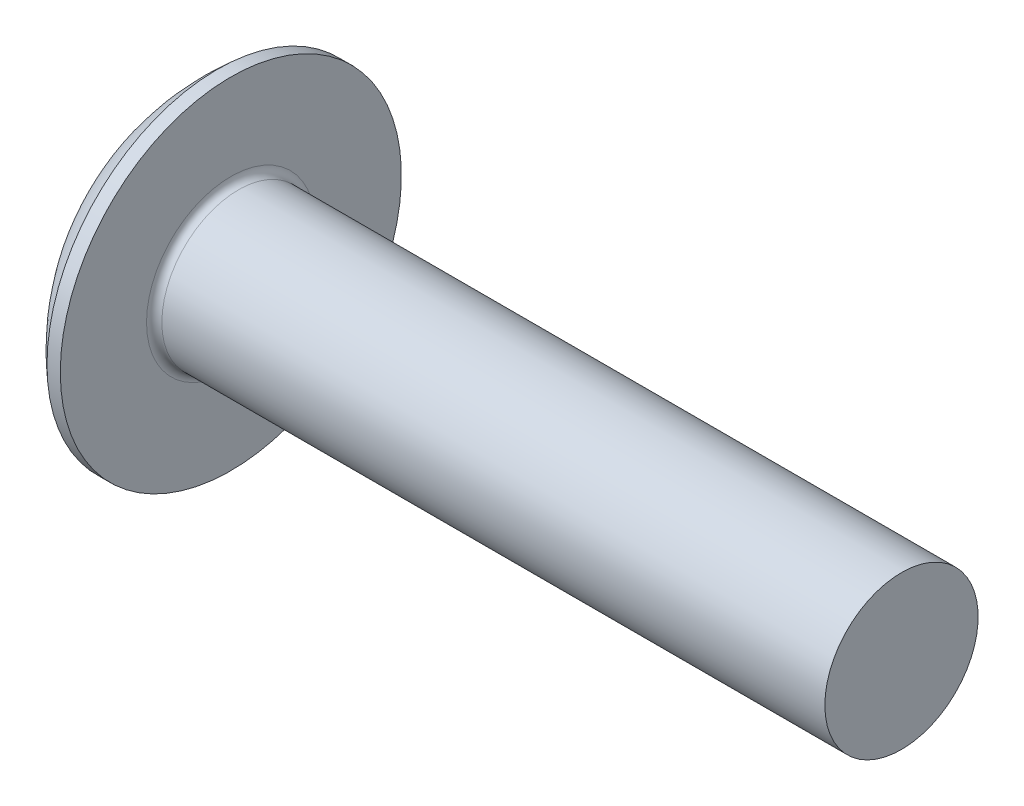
SolidWorks part; units mm, degrees
ref_plane "Plane1" through (0, 0, 0) normal (0, 0, 1) x (1, 0, 0)
ref_plane "Plane2" through (0, 0, 0) normal (0, 1, 0) x (1, 0, 0)
ref_plane "Plane3" through (0, 0, 0) normal (1, 0, 0) x (0, 0, -1)
sketch "BodySke" plane through (0, 0, 0) normal (0, 0, 1) x (1, 0, 0)
  line L0 (4.8, 4) -> (4.8, 8.9)
  line L1 (4.8, 8.9) -> (4.1053, 8.9)
  line L2 (-25.4, 0) -> (127, 0) construction
  line L4 (4.8, 4) -> (39.8, 4)
  line L5 (39.8, 4) -> (39.8, 0)
  line L6 (39.8, 0) -> (0, 0)
  line L7 (4.8, -4) -> (39.8, -4) construction
  line L8 (6.05, 6.35) -> (6.05, -3.175) construction
  line L9 (9.8, 6.35) -> (9.8, -3.175) construction
  arc A0 (0, 0) -> (4.1053, 8.9) centre (11.7, 0) cw
  dimension "Oval_rad" = 11.7
  dimension "Head_ht" = 4.8
  dimension "Diameter" = 8
  dimension "Length" = 35
  dimension "Head_dia" = 17.8
  dimension "Advance" = 1.25
  dimension "Thread_nom" = 30
revolve "Base-Revolve" add sketch "BodySke"
fillet "Fillet1" radius 0.4 1 edges at (4.8, 0, 4)
sketch "Sketch2" plane through (0, 0, 0) normal (1, 0, 0) x (0, 0, -1)
  line L0 (8.9, -0.8) -> (8.9, 0.8)
  line L1 (8.9, 0.8) -> (-8.9, 0.8)
  line L2 (-8.9, 0.8) -> (-8.9, -0.8)
  line L3 (-8.9, -0.8) -> (8.9, -0.8)
  dimension "D1" = 17.8
  dimension "D2" = 8.9
  dimension "D3" = 0.8
  dimension "Slot_width" = 1.6
extrude "Slot" cut sketch "Sketch2" along normal blind 2.4
sketch "ThdSchSke" plane through (0, 0, 0) normal (0, 0, 1) x (1, 0, 0)
  line L0 (9.8, -3.3095) -> (9.3165, -4)
  line L1 (9.8, -3.3095) -> (10.2835, -4)
  line L2 (10.2835, -4) -> (10.2835, -5)
  line L3 (-3.175, 0) -> (5.1513, 0) construction
  line L5 (10.2835, -5) -> (9.3165, -5)
  line L6 (9.3165, -5) -> (9.3165, -4)
  dimension "Thread_minor" = 6.619
  dimension "Diameter" = 8
  dimension "Start" = 9.8
  dimension "SideAngle" = 55
  dimension "VeeAngle" = 70
  dimension "Overcut" = 10
revolve "ThreadSchematic" [suppressed] cut sketch "ThdSchSke" angle 360 about L3
pattern_linear "ThdSchPat" [suppressed]
equation "' \"Diameter@BodySke\" = 8"
equation "' \"Length@BodySke\" = 35"
equation "' \"Head_dia@BodySke\" = 17.8"
equation "' \"Oval_rad@BodySke\" = 11.7"
equation "' \"Head_ht@BodySke\" = 4.8"
equation "' \"Thread_nom@BodySke\" =  30"
equation "' \"Slot_width@Sketch2\" = 1.6"
equation "' \"Slot_depth@Slot\" = 2.4"
equation "' \"Thread_minor@ThreadCosmetic\" = 6.619"
equation "' \"Advance@BodySke\" = 1.25"
equation "\"D1@Sketch2\" = \"Head_dia@BodySke\""
equation "\"D2@Sketch2\" = \"D1@Sketch2\" / 2"
equation "\"D3@Sketch2\" = \"Slot_width@Sketch2\" / 2"
equation "\"Thread_length@ThreadCosmetic\" = ((sgn( (\"Length@BodySke\" - \"Advance@BodySke\" * 2 ) - \"Thread_nom@BodySke\" )-1)*( (\"Length@BodySke\" - \"Advance@BodySke\" * 2 ) - \"Thread_nom@BodySke\" ))/-2+ \"Thread_nom@"
equation "\"Thread_minor@ThdSchSke\" = \"Thread_minor@ThreadCosmetic\""
equation "\"Diameter@ThdSchSke\" = \"Diameter@BodySke\""
equation "\"Overcut@ThdSchSke\" = \"Diameter@BodySke\" * 1.25"
equation "\"Start@ThdSchSke\" = \"Head_ht@BodySke\" + \"Length@BodySke\" - \"Thread_length@ThreadCosmetic\"  '---Non-countersunk---"
equation "\"Num_threads@ThdSchPat\" = int( \"Thread_length@ThreadCosmetic\" / \"Advance@BodySke\" + 0.999 )  + 1"
equation "\"Advance@ThdSchPat\" = \"Thread_length@ThreadCosmetic\" /  (\"Num_threads@ThdSchPat\" - 1) 'relax it"
